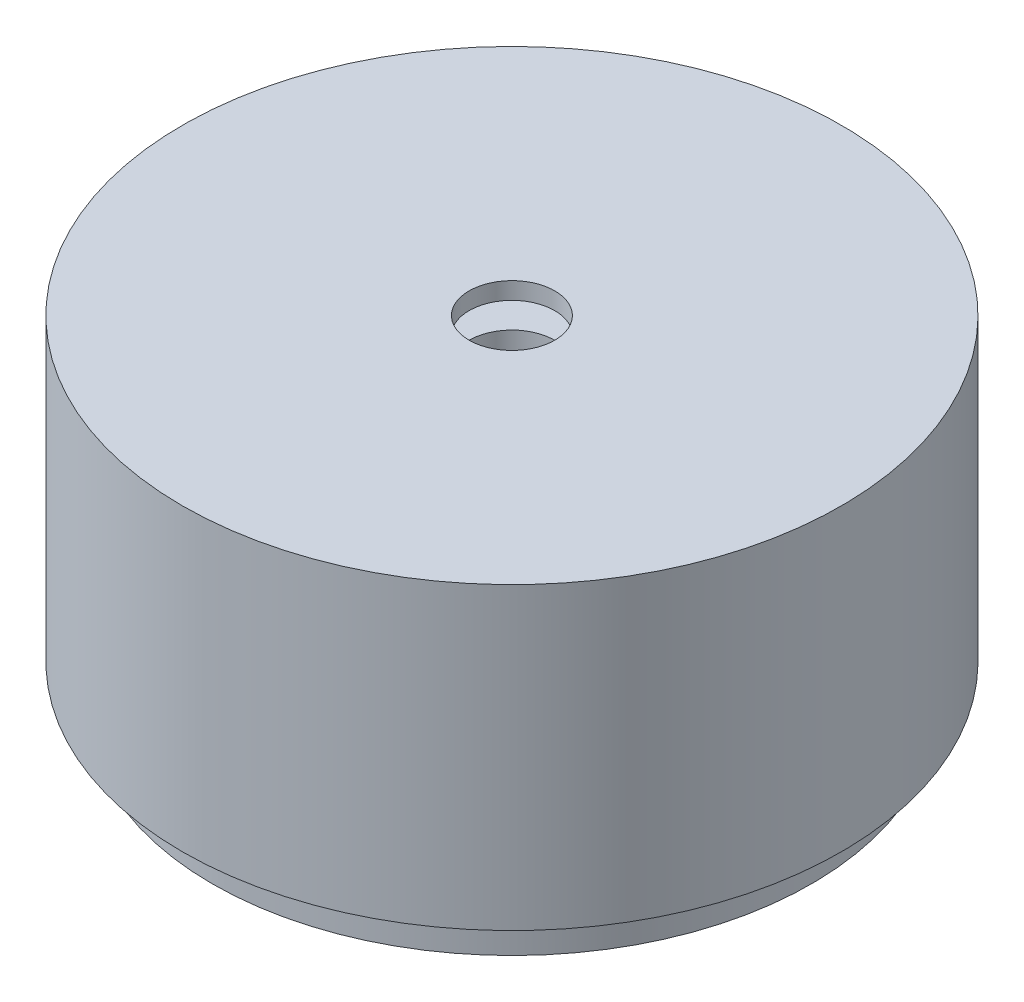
SolidWorks part; units mm, degrees
ref_plane "Ebene vorne" through (0, 0, 0) normal (0, 0, 1) x (1, 0, 0)
ref_plane "Ebene oben" through (0, 0, 0) normal (0, 1, 0) x (1, 0, 0)
ref_plane "Ebene rechts" through (0, 0, 0) normal (1, 0, 0) x (0, 0, -1)
sketch "Skizze1" plane through (0, 0, 0) normal (0, 1, 0) x (1, 0, 0)
  circle A0 centre (0, 0) radius 35
  dimension "D1" = 70
extrude "Aufsatz-Linear austragen1" add sketch "Skizze1" along normal blind 35
sketch "Skizze2" plane through (0, 35, 0) normal (0, 1, 0) x (1, 0, 0)
  circle A0 centre (0, 0) radius 38.5
  circle A1 centre (0, 0) radius 36.5
  dimension "D1" = 73
  dimension "D2" = 2
extrude "Aufsatz-Linear austragen2" add sketch "Skizze2" against normal blind 30 and the other way blind 3 separate body
sketch "Skizze7" plane through (0, 38, 0) normal (0, 1, 0) x (1, 0, 0)
  circle A0 centre (0, 0) radius 38.5
extrude "Aufsatz-Linear austragen4" add sketch "Skizze7" along normal blind 2
sketch "Skizze8" plane through (0, 40, 0) normal (0, 1, 0) x (1, 0, 0)
  circle A0 centre (0, 0) radius 5
  dimension "D1" = 10
extrude "Schnitt-Linear austragen2" cut sketch "Skizze8" against normal through all
